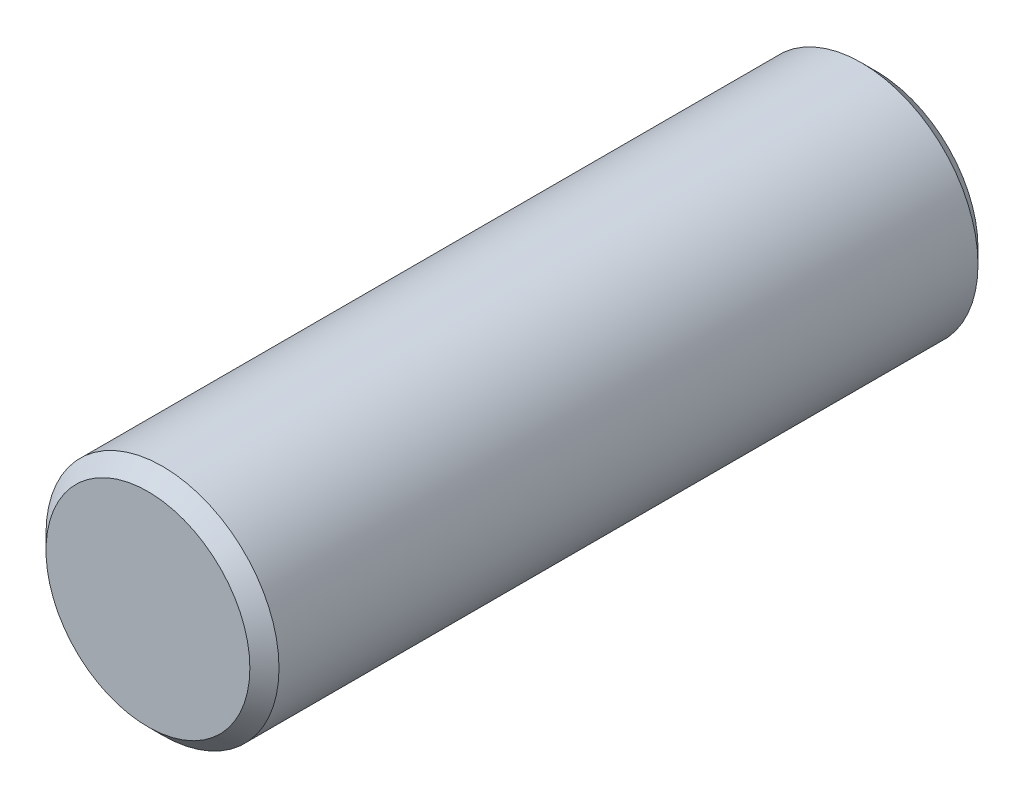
SolidWorks part; units mm, degrees
ref_plane "Plan de face" through (0, 0, 0) normal (0, 0, 1) x (1, 0, 0)
ref_plane "Plan de dessus" through (0, 0, 0) normal (0, 1, 0) x (1, 0, 0)
ref_plane "Plan de droite" through (0, 0, 0) normal (1, 0, 0) x (0, 0, -1)
sketch "Esquisse1" plane through (0, 0, 0) normal (0, 0, 1) x (1, 0, 0)
  circle A0 centre (0, 0) radius 8
  dimension "D1" = 16
extrude "Boss.-Extru.1" add sketch "Esquisse1" along normal blind 50
chamfer "Chanfrein1" distance 1 angle 45 2 edges at (8, 0, 0) (8, 0, 50)
